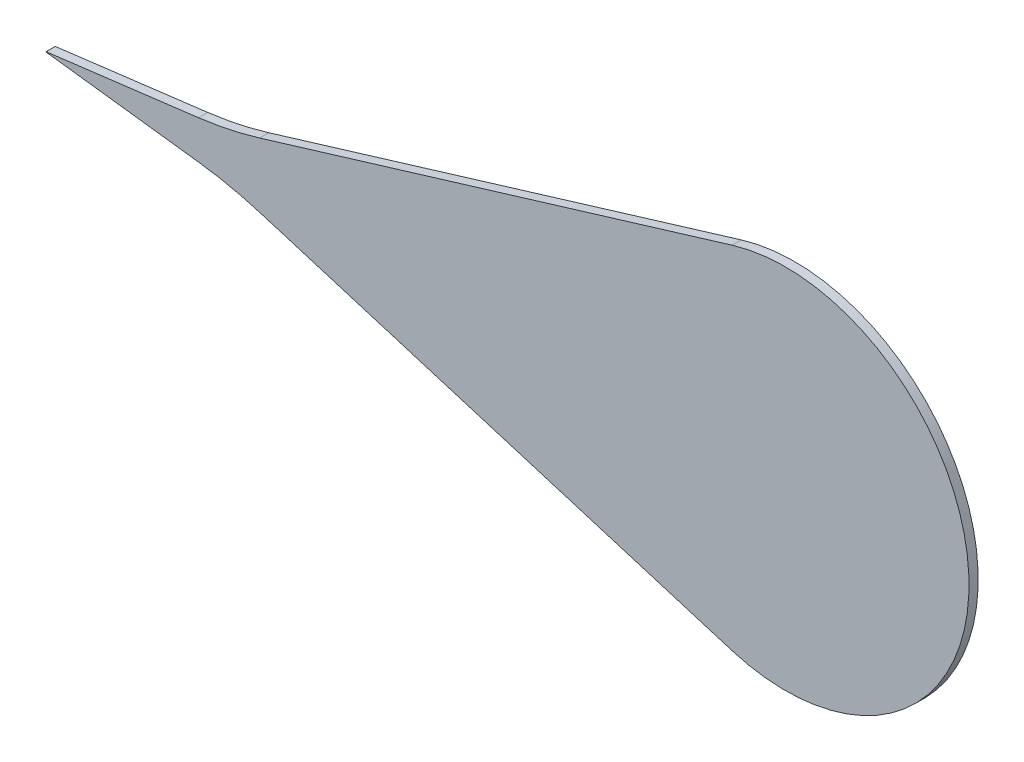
SolidWorks part; units mm, degrees
ref_plane "前基準面" through (0, 0, 0) normal (0, 0, 1) x (1, 0, 0)
ref_plane "上基準面" through (0, 0, 0) normal (0, 1, 0) x (1, 0, 0)
ref_plane "右基準面" through (0, 0, 0) normal (1, 0, 0) x (0, 0, -1)
sketch "草圖1" plane through (0, 0, 0) normal (0, 0, 1) x (1, 0, 0)
  line L0 (0.3574, 0.005) -> (20.1903, 2.4807) construction
  line L5 (0.3574, -0.005) -> (20.1903, -2.4807) construction
  line L6 (0.3574, 0.005) -> (4.5094, 0.5233)
  line L7 (0.3574, -0.005) -> (4.5094, -0.5233)
  line L8 (6.1751, 0.8773) -> (19.0478, 4.7845)
  line L9 (6.1751, -0.8773) -> (19.0478, -4.7845)
  line L18 (0, 0) -> (0.358, 0) construction
  line L19 (0, 0) -> (-0.179, 0.31) construction
  line L20 (0, 0) -> (-0.179, -0.31) construction
  circle A0 centre (0, 0) radius 0.353 construction
  arc A1 (0.3574, 0.005) -> (0.3574, -0.005) centre (0.358, 0) ccw
  circle A2 centre (20.5, 0) radius 2.5 construction
  arc A3 (19.0478, -4.7845) -> (19.0478, 4.7845) centre (20.5, 0) ccw
  arc A4 (4.5094, -0.5233) -> (6.1751, -0.8773) centre (3.2707, -10.4463) cw
  arc A5 (4.5094, 0.5233) -> (6.1751, 0.8773) centre (3.2707, 10.4463) ccw
  point P18 (5.3574, -0.6291)
  point P21 (5.3574, 0.6291)
  point P46 (0, 0)
  dimension "D1" = 0.706
  dimension "D2" = 0.01
  dimension "D3" = 5
  dimension "D4" = 20.5
  dimension "D6" = 10
  dimension "D7" = 10
  dimension "D5" = 5
  dimension "D9" = 120
  dimension "D10" = 120
  dimension "D12" = 14.231
extrude "填料-伸長2" add sketch "草圖1" along normal blind 0.25
